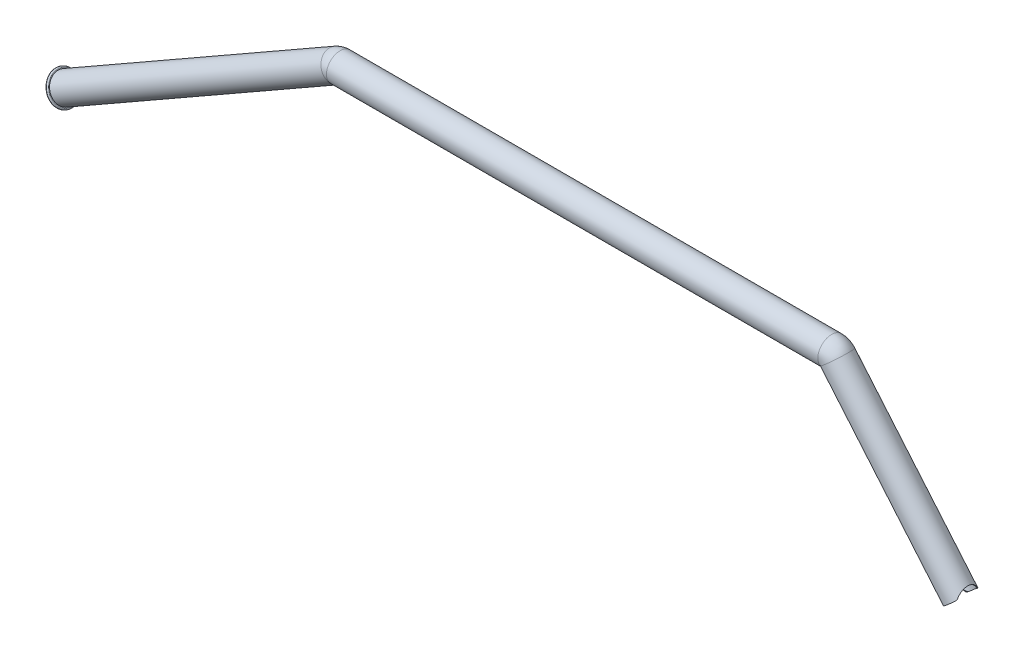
SolidWorks part; units mm, degrees
ref_plane "Plan de face" through (0, 0, 0) normal (0, 0, 1) x (1, 0, 0)
ref_plane "Plan de dessus" through (0, 0, 0) normal (0, 1, 0) x (1, 0, 0)
ref_plane "Plan de droite" through (0, 0, 0) normal (1, 0, 0) x (0, 0, -1)
sketch "Esquisse1" plane through (0, 0, 0) normal (0, 0, 1) x (1, 0, 0)
  line L0 (0, 0) -> (347.6943, 198.6824)
  line L1 (352.6556, 200) -> (979.1604, 200)
  line L2 (986.8096, 196.4414) -> (1143.8128, 10)
  arc A0 (352.6556, 200) -> (347.6943, 198.6824) centre (352.6556, 190) ccw
  arc A1 (986.8096, 196.4414) -> (979.1604, 200) centre (979.1604, 190) ccw
  point P7 (350, 200)
  point P10 (983.8128, 200)
  dimension "D6" = 10
  dimension "D1" = 350
  dimension "D2" = 200
  dimension "D3" = 633.8128
  dimension "D4" = 160
  dimension "D5" = 190
ref_plane "Plan1" through (0, 0, 0) normal (0.8682, 0.4961, 0) x (0, 0, -1)
sketch "Esquisse2" plane through (0, 0, 0) normal (0.8682, 0.4961, 0) x (0, 0, -1)
  circle A0 centre (0, 0) radius 17.5
  circle A1 centre (0, 0) radius 16.5
  dimension "D1" = 35
  dimension "D2" = 33
sweep "Balayage1" add profiles "Esquisse2" path "Esquisse1"
ref_plane "Plan2" through (868.2431, 496.1389, 0) normal (0.8682, 0.4961, 0) x (0, 0, -1)
sketch "Esquisse3" plane through (868.2431, 496.1389, 0) normal (0.8682, 0.4961, 0) x (0, 0, -1)
  circle A0 centre (0, -563.8076) radius 15
  ellipse E0 centre (0, -558.8076) end of major axis (-17.5, -558.8076) minor radius 3.1459 construction
  dimension "D1" = 30
  dimension "D2" = 5
extrude "Enlèv. mat.-Extru.1" cut sketch "Esquisse3" against normal through all and the other way through all
fillet "Congé1" radius 1.5 8 edges at (1151.8725, 16.7871, -13.3218) (1137.1772, 4.4121, -14.6001) (1137.1772, 4.4121, 14.6001) (1151.8725, 16.7871, 13.3218) (1152.707, 26.559, -1.0319) (1121.8197, 8.9494, 0.1302) (1122.7018, 9.4539, -0.0678) (1151.8032, 25.8889, 2.2451)
sketch "Esquisse4" plane through (0, 0, 0) normal (0.8682, 0.4961, 0) x (0, 0, -1)
  circle A0 centre (0, 0) radius 20
  dimension "D1" = 40
extrude "Extrusion1" add sketch "Esquisse4" along normal blind 2
fillet "Congé2" radius 1.5 1 edges at (-8.1863, 18.3571, 0)
sketch "Esquisse5" plane through (0, 0, 0) normal (-0.8682, -0.4961, 0) x (0, 0, 1)
  circle A0 centre (0, 0) radius 4
  dimension "D1" = 8
extrude "Enlèv. mat.-Extru.2" cut sketch "Esquisse5" against normal blind 2
